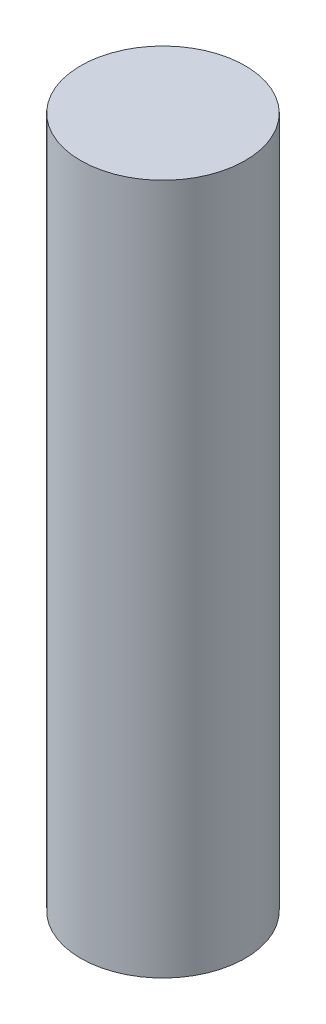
SolidWorks part; units mm, degrees
ref_plane "Front Plane" through (0, 0, 0) normal (0, 0, 1) x (1, 0, 0)
ref_plane "Top Plane" through (0, 0, 0) normal (0, 1, 0) x (1, 0, 0)
ref_plane "Right Plane" through (0, 0, 0) normal (1, 0, 0) x (0, 0, -1)
sketch "Sketch1" plane through (0, 0, 0) normal (0, 1, 0) x (1, 0, 0)
  circle A0 centre (0, 0) radius 6.35
  dimension "D1" = 12.7
extrude "Boss-Extrude1" add sketch "Sketch1" along normal blind 53.34
